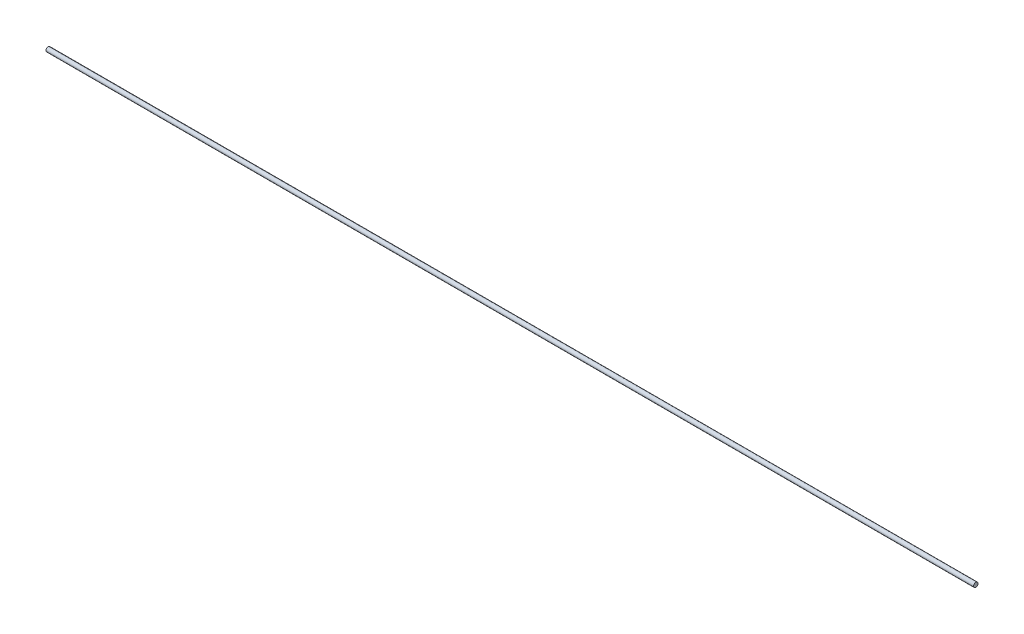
SolidWorks part; units mm, degrees
ref_plane "Front Plane" through (0, 0, 0) normal (1, 0, 0) x (0, 1, 0)
ref_plane "Top Plane" through (0, 0, 0) normal (0, 0, 1) x (0, 1, 0)
ref_plane "Right Plane" through (0, 0, 0) normal (0, 1, 0) x (-1, 0, 0)
sketch "Sketch1" plane through (0, 0, 0) normal (1, 0, 0) x (0, 1, 0)
  circle A0 centre (0, 0) radius 14.3256
  dimension "D1" = 28.6512
extrude "N9 - 1.128in - 20ft" add sketch "Sketch1" along normal mid plane 5993.1
ref_plane "6.9in offset 1" through (2821.675, 0, 0) normal (1, 0, 0) x (0, 1, 0)
ref_plane "6.9in offset 2" through (-2821.675, 0, 0) normal (-1, 0, 0) x (0, -1, 0)
